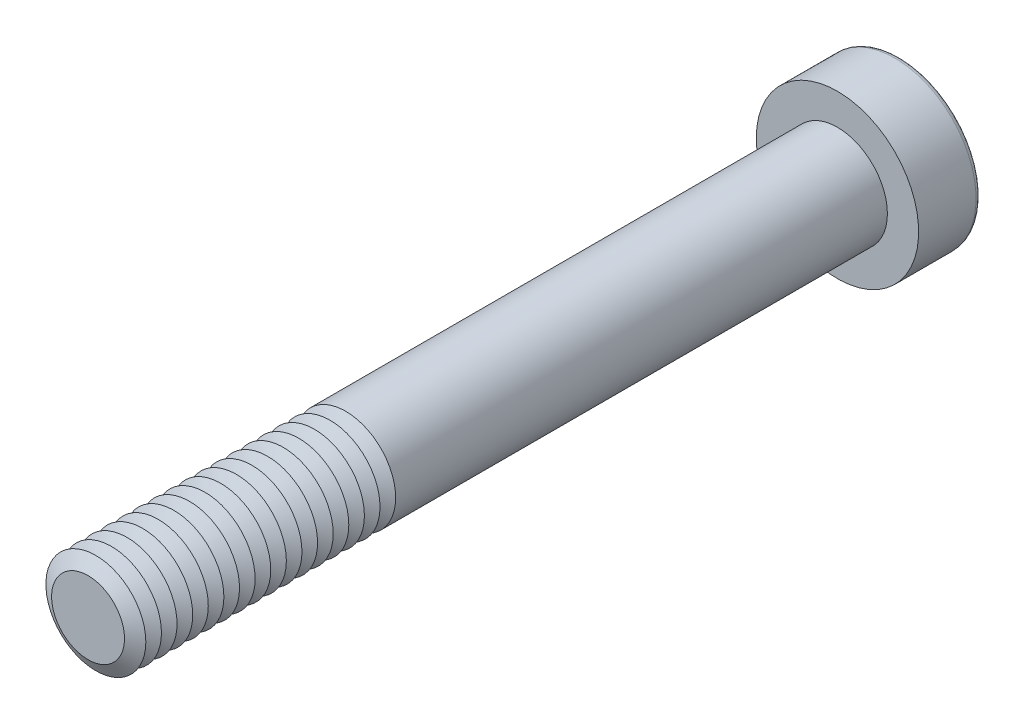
SolidWorks part; units mm, degrees
ref_plane "Front Plane" through (0, 0, 0) normal (0, 0, 1) x (1, 0, 0)
ref_plane "Top Plane" through (0, 0, 0) normal (0, 1, 0) x (1, 0, 0)
ref_plane "Right Plane" through (0, 0, 0) normal (1, 0, 0) x (0, 0, -1)
sketch "Sketch1" plane through (0, 0, 0) normal (0, 0, 1) x (1, 0, 0)
  circle A0 centre (0, 0) radius 4
  dimension "D1" = 8
extrude "Boss-Extrude1" add sketch "Sketch1" along normal blind 60
sketch "Sketch2" plane through (0, 0, 0) normal (0, 0, -1) x (-1, 0, 0)
  circle A0 centre (0, 0) radius 6.5
  dimension "D1" = 13
extrude "Boss-Extrude2" add sketch "Sketch2" along normal blind 5
sketch "Sketch3" plane through (0, 0, -5) normal (0, 0, -1) x (-1, 0, 0)
  line L1 (-1.4434, 2.5) -> (-2.8868, 0)
  line L2 (-2.8868, 0) -> (-1.4434, -2.5)
  line L3 (-1.4434, -2.5) -> (1.4434, -2.5)
  line L4 (1.4434, -2.5) -> (2.8868, 0)
  line L5 (2.8868, 0) -> (1.4434, 2.5)
  line L6 (1.4434, 2.5) -> (-1.4434, 2.5)
  circle A0 centre (0, 0) radius 2.5 construction
  dimension "D1" = 5
extrude "Cut-Extrude1" cut sketch "Sketch3" against normal blind 3.75
fillet "Fillet1" radius 0.4 1 edges at (-6.5, 0, -5)
sketch "Sketch4" plane through (0, 0, -1.25) normal (0, 0, -1) x (-1, 0, 0)
  line L0 (1.4434, -2.5) -> (2.8868, 0) construction
  circle A0 centre (0, 0) radius 2.5
extrude "Cut-Extrude2" cut sketch "Sketch4" against normal through all draft 60
sketch "Sketch5" plane through (0, 0, -5) normal (0, 0, -1) x (-1, 0, 0)
  circle A0 centre (0, 0) radius 2.8868
extrude "Cut-Extrude3" cut sketch "Sketch5" against normal through all draft 75
sketch "Sketch7" plane through (0, 0, 0) normal (1, 0, 0) x (0, 0, -1)
  line L25 (-60, 2.9175) -> (-59.375, 4)
  line L26 (-60, 4) -> (-60, -4) construction
  line L27 (-59.375, 4) -> (-60.625, 4)
  line L28 (-60.625, 4) -> (-60, 2.9175)
  line L29 (0, 4) -> (-60, 4) construction
  dimension "D1" = 1.25
revolve "Cut-Revolve1" cut sketch "Sketch7" angle 360 about axis through (0, 0, 60) along (0, 0, -1)
pattern_linear "LPattern1" count 17 spacing 1.25 along (0, 0, -1) of "Cut-Revolve1"
